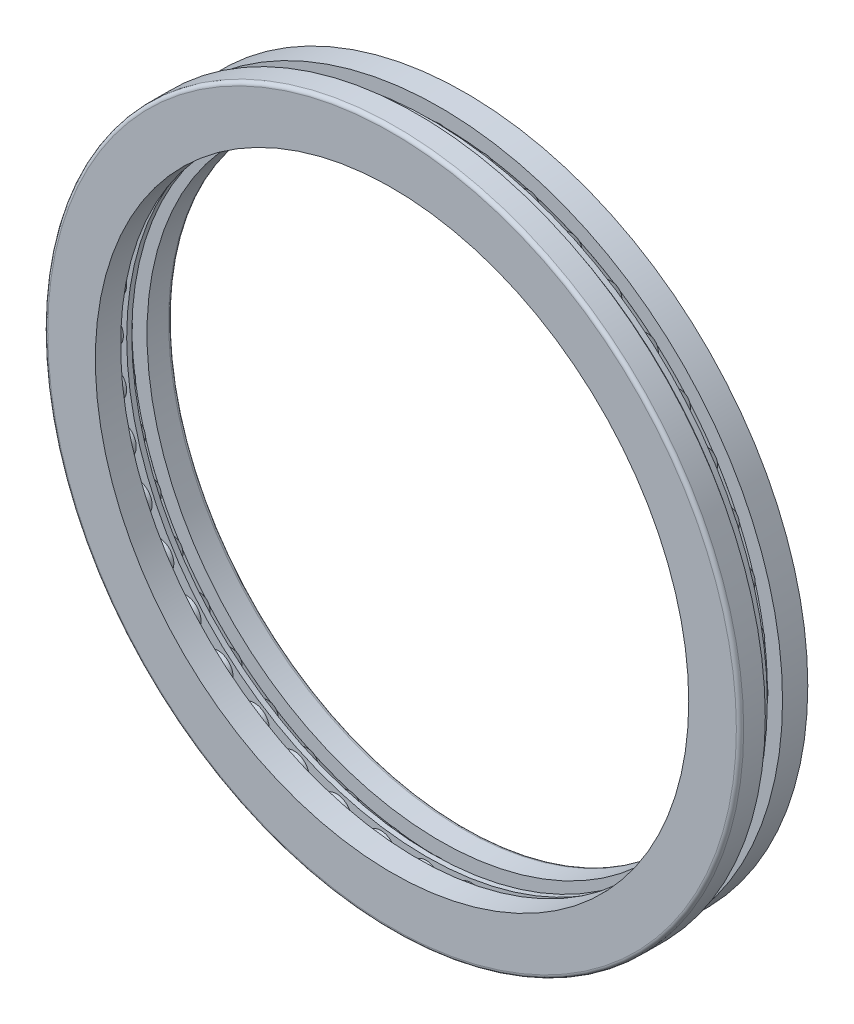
SolidWorks part; units mm, degrees
ref_plane "Front Plane" through (0, 0, 0) normal (0, 0, 1) x (1, 0, 0)
ref_plane "Top Plane" through (0, 0, 0) normal (0, 1, 0) x (1, 0, 0)
ref_plane "Right Plane" through (0, 0, 0) normal (1, 0, 0) x (0, 0, -1)
sketch "BaseSke" plane through (0, 0, 0) normal (1, 0, 0) x (0, 0, -1)
  line L0 (-22.7078, 0) -> (24.6132, 0) construction
  line L1 (-22.7078, 43.375) -> (24.6132, 43.375) construction
  line L2 (0, 129.5214) -> (0, -86.3012) construction
  line L3 (0, 45.4583) -> (0, 41.2917)
  line L6 (-5, 47.5) -> (-5, 40.5) construction
  line L8 (5, 46.75) -> (5, 40) construction
  arc A0 (0, 45.4583) -> (0, 41.2917) centre (0, 43.375) ccw
  dimension "D2" = 5
  dimension "Ball_diameter" = 4.1667
  dimension "D1" = 43.375
  dimension "Bearing_Thickness" = 10
  dimension "Diameter2" = 93.5
  dimension "Bearing_Inside_Diameter" = 80
  dimension "Diameter1" = 81
  dimension "Bearing_Outside_Diameter" = 95
revolve "Ball" add sketch "BaseSke" angle 360 about L3
sketch "InnerRaceSke" plane through (0, 0, 0) normal (1, 0, 0) x (0, 0, -1)
  line L0 (1.5517, 42.061) -> (1.5517, 40)
  line L1 (1.5517, 46.75) -> (5, 46.75)
  line L2 (1.5517, 46.75) -> (1.5517, 44.689)
  line L3 (1.5517, 40) -> (5, 40)
  line L4 (5, 46.75) -> (5, 40)
  line L5 (-18.959, 0) -> (19.5136, 0) construction
  arc A0 (1.5517, 42.061) -> (1.5517, 44.689) centre (0, 43.375) ccw
  arc A2 (0, 45.4583) -> (0, 41.2917) centre (0, 43.375) ccw construction
  dimension "D1" = 4.0667
  dimension "D2" = 3.4483
revolve "InnerRace" add sketch "InnerRaceSke" angle 360 about L5
sketch "OuterRaceSke" plane through (0, 0, 0) normal (1, 0, 0) x (0, 0, -1)
  line L0 (-1.5517, 42.061) -> (-1.5517, 40.5)
  line L1 (-5, 47.5) -> (-1.5517, 47.5)
  line L2 (-5, 47.5) -> (-5, 40.5)
  line L3 (-5, 40.5) -> (-1.5517, 40.5)
  line L4 (-1.5517, 47.5) -> (-1.5517, 44.689)
  line L5 (-27.1643, 0) -> (37.3715, 0) construction
  arc A0 (-1.5517, 44.689) -> (-1.5517, 42.061) centre (0, 43.375) ccw
  arc A1 (0, 45.4583) -> (0, 41.2917) centre (0, 43.375) ccw construction
  dimension "D1" = 4.0667
  dimension "D2" = 3.4483
revolve "OuterRace" add sketch "OuterRaceSke" angle 360 about L5
fillet "Fillet1" radius 0.5 2 edges at (47.5, 0, 5) (40, 0, -5)
pattern_circular "CirPatternBall" count 44 over 360 about axis through (0, 0, 0) along (0, 0, 1) of "Ball"
sketch "CageSke" plane through (0, 0, 0) normal (1, 0, 0) x (0, 0, -1)
  line L0 (0, 59.1614) -> (0, 0) construction
  line L1 (0.3472, 45.875) -> (-0.3472, 45.875)
  line L2 (0.3472, 45.875) -> (0.3472, 40.875)
  line L3 (0.3472, 40.875) -> (-0.3472, 40.875)
  line L4 (-0.3472, 45.875) -> (-0.3472, 40.875)
  line L5 (-23.077, 0) -> (28.998, 0) construction
  circle A0 centre (0, 43.375) radius 2.524 construction
  arc A1 (0, 45.4583) -> (0, 41.2917) centre (0, 43.375) ccw construction
  dimension "D1" = 0.6944
  dimension "D2" = 5
revolve "Cage" add sketch "CageSke" angle 360 about L5
sketch "SimplifiedSke" plane through (0, 0, 0) normal (1, 0, 0) x (0, 0, -1)
  line L0 (-32.3536, 0) -> (41.9236, 0) construction
  circle A0 centre (0, 43.375) radius 2.0833
  arc A1 (0, 45.4583) -> (0, 41.2917) centre (0, 43.375) ccw construction
revolve "Simplified" [suppressed] add sketch "SimplifiedSke" angle 360 about L0
equation "\"Diameter2@BaseSke\" =  int(  \"Bearing_Outside_Diameter@BaseSke\" * 0.98 )  + 0.5"
equation "\"Diameter1@BaseSke\" =  int(  \"Bearing_Inside_Diameter@BaseSke\"  * 1.002)  + 1"
equation "\"D2@BaseSke\" = \"Bearing_Thickness@BaseSke\"/2"
equation "\"D1@BaseSke\" =  ( \"Diameter2@BaseSke\" + \"Bearing_Inside_Diameter@BaseSke\" )  / 4"
equation "\"Ball_diameter@BaseSke\" = \"Bearing_Thickness@BaseSke\"  / 2.4"
equation "\"D1@InnerRaceSke\" = \"Ball_diameter@BaseSke\"-0.02-\"Bearing_Inside_Diameter@BaseSke\"*0.001"
equation "\"D2@InnerRaceSke\" = \"Bearing_Thickness@BaseSke\"/2.9"
equation "\"D1@OuterRaceSke\" = \"Ball_diameter@BaseSke\"-0.02-\"Bearing_Inside_Diameter@BaseSke\"*0.001"
equation "\"D2@OuterRaceSke\" = \"Bearing_Thickness@BaseSke\" / 2.9"
equation "\"D1@CirPatternBall\" =  pi  * \"D1@BaseSke\" * 2 / \"Ball_diameter@BaseSke\"/1.5"
equation "\"D1@CageSke\" = \"Ball_diameter@BaseSke\"/6"
equation "\"D2@CageSke\" = \"Ball_diameter@BaseSke\" * 1.2"
